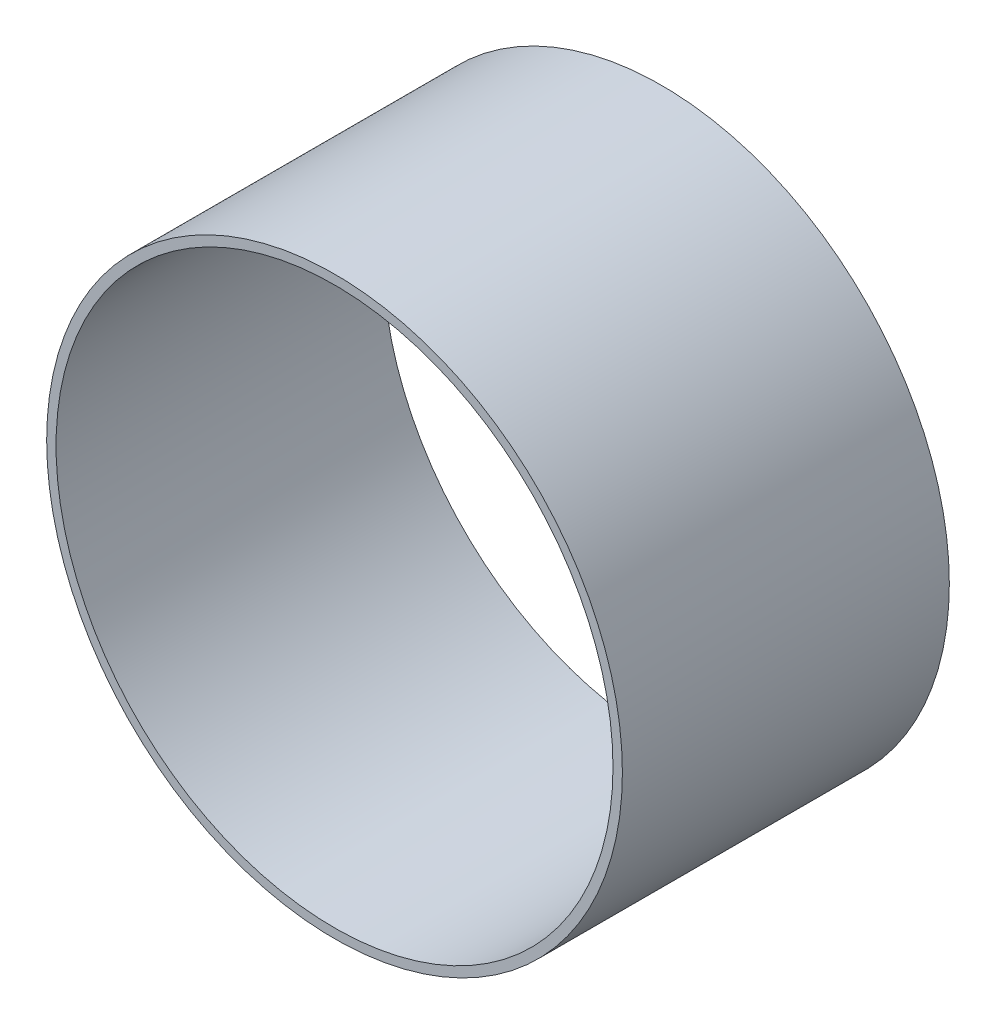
SolidWorks part; units mm, degrees
ref_plane "Front Plane" through (0, 0, 0) normal (0, 0, 1) x (1, 0, 0)
ref_plane "Top Plane" through (0, 0, 0) normal (0, 1, 0) x (1, 0, 0)
ref_plane "Right Plane" through (0, 0, 0) normal (1, 0, 0) x (0, 0, -1)
sketch "Sketch1" plane through (0, 0, 0) normal (0, 0, 1) x (1, 0, 0)
  line L0 (0, 63.5108) -> (0, -69.027) construction
  line L1 (-67.9089, 0) -> (60.4545, 0) construction
  circle A1 centre (0, 0) radius 22.9514
  dimension "D1" = 45.9029
extrude "Extrude-Thin1" add sketch "Sketch1" along normal mid plane 26.5 thin
sketch "Sketch2" plane through (0, 0, 13.25) normal (0, 0, 1) x (1, 0, 0)
  line L0 (0, 0) -> (0, -19.3725) construction
  line L1 (0, 0) -> (-19.34, 11.166) construction
  line L2 (0, 0) -> (21.5073, 12.4173) construction
  line L3 (-19.3466, 11.6246) -> (-19.1289, 11.4938)
  line L4 (-19.7406, 10.9424) -> (-19.5184, 10.8192)
  arc A0 (-19.1289, 11.4938) -> (-19.5184, 10.8192) centre (0, 0) ccw
  circle A1 centre (0, 0) radius 22.5704 construction
  arc A2 (-19.3466, 11.6246) -> (-19.7406, 10.9424) centre (0, 0) ccw
  dimension "D3" = 0.254
  dimension "D1" = 120
  dimension "D2" = 120
  dimension "D4" = 1
extrude "Boss-Extrude1" [suppressed] add sketch "Sketch2" against normal blind 1.905
pattern_circular "CirPattern1" [suppressed] count 3 over 360
mirror "Mirror6" [suppressed] about plane through (0, 0, 0) normal (0, 0, 1)
